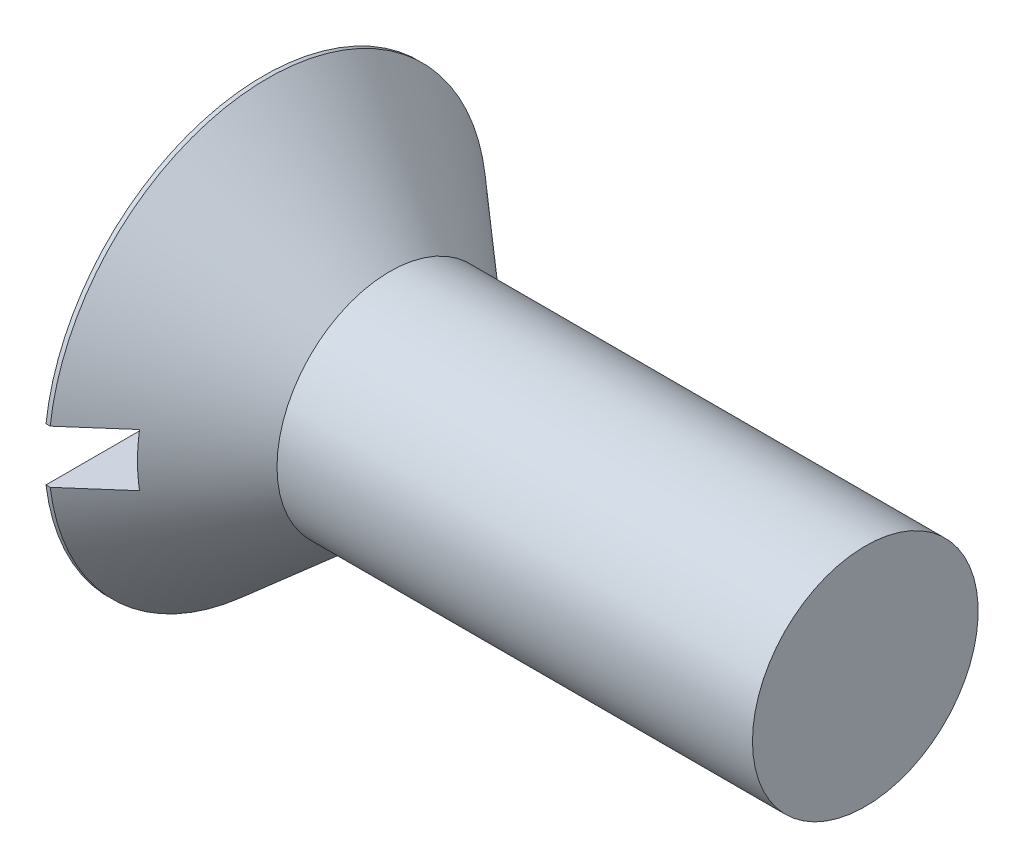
SolidWorks part; units mm, degrees
ref_plane "Plane1" through (0, 0, 0) normal (0, 0, 1) x (1, 0, 0)
ref_plane "Plane2" through (0, 0, 0) normal (0, 1, 0) x (1, 0, 0)
ref_plane "Plane3" through (0, 0, 0) normal (1, 0, 0) x (0, 0, -1)
revolve "Base-Revolve" add sketch "BodySke" angle 360 about L5
sketch "BodySke" plane through (0, 0, 0) normal (0, 0, 1) x (1, 0, 0)
  line L0 (0, 0) -> (0, 9.2456)
  line L1 (0, 9.2456) -> (0.1768, 9.2456)
  line L2 (5.334, 4.7625) -> (25.4, 4.7625)
  line L3 (25.4, 4.7625) -> (25.4, 0)
  line L4 (25.4, 0) -> (0, 0)
  line L5 (-6.35, 0) -> (82.55, 0) construction
  line L6 (5.334, -4.7625) -> (25.4, -4.7625) construction
  line L7 (0.1768, -9.2456) -> (5.334, -4.7625) construction
  line L8 (0.1768, 9.2456) -> (5.334, 4.7625)
  line L9 (0, -9.2456) -> (0.1768, -9.2456) construction
  line L10 (6.9215, 6.35) -> (6.9215, -3.175) construction
  line L11 (0, 6.35) -> (0, -3.175) construction
  dimension "Diameter" = 9.525
  dimension "Length" = 25.4
  dimension "Head_ht" = 5.334
  dimension "Head_dia" = 18.4912
  dimension "Head_ang" = 82
  dimension "D6" = 0.1768
  dimension "Advance" = 1.5875
  dimension "Thread_nom" = 25.4
extrude "Slot" cut sketch "Sketch6" against normal blind 2.1844
sketch "Sketch6" plane through (0, 0, 0) normal (-1, 0, 0) x (0, 0, 1)
  line L0 (-9.2456, -1.1176) -> (9.2456, -1.1176)
  line L1 (-9.2456, -1.1176) -> (-9.2456, 1.1176)
  line L2 (9.2456, 1.1176) -> (-9.2456, 1.1176)
  line L3 (9.2456, 1.1176) -> (9.2456, -1.1176)
  dimension "D1" = 1.1176
  dimension "Slot_width" = 2.2352
  dimension "D2" = 18.4912
  dimension "D3" = 9.2456
sketch "ThdSchSke" plane through (0, 0, 0) normal (0, 0, 1) x (1, 0, 0)
  line L0 (6.9215, -3.8163) -> (6.259, -4.7625)
  line L1 (6.9215, -3.8163) -> (7.584, -4.7625)
  line L2 (7.584, -4.7625) -> (7.584, -5.9531)
  line L3 (-3.175, 0) -> (5.1513, 0) construction
  line L5 (7.584, -5.9531) -> (6.259, -5.9531)
  line L6 (6.259, -5.9531) -> (6.259, -4.7625)
  line L7 (0, 9.2456) -> (0, 1.1176) construction
  dimension "Thread_minor" = 7.6327
  dimension "Diameter" = 9.525
  dimension "Start" = 6.9215
  dimension "SideAngle" = 55
  dimension "VeeAngle" = 70
  dimension "Overcut" = 11.9063
revolve "ThreadSchematic" [suppressed] cut sketch "ThdSchSke" angle 360 about L3
pattern_linear "ThdSchPat" [suppressed]
equation "\"D1@Sketch6\" = \"Slot_width@Sketch6\" / 2"
equation "\"D2@Sketch6\" = \"Head_dia@BodySke\""
equation "\"D3@Sketch6\" = \"D2@Sketch6\" / 2"
equation "\"Thread_length@ThreadCosmetic\" = ((sgn( (\"Length@BodySke\" - \"Advance@BodySke\" - \"Head_ht@BodySke\" ) - \"Thread_nom@BodySke\" )-1)*( (\"Length@BodySke\" - \"Advance@BodySke\" - \"Head_ht@BodySke\" ) - \"Thread_"
equation "\"Thread_minor@ThdSchSke\" = \"Thread_minor@ThreadCosmetic\""
equation "\"Diameter@ThdSchSke\" = \"Diameter@BodySke\""
equation "\"Overcut@ThdSchSke\" = \"Diameter@BodySke\" * 1.25"
equation "\"Start@ThdSchSke\" = 0.000001 + \"Length@BodySke\" - \"Thread_length@ThreadCosmetic\"  '---Countersunk---"
equation "\"Num_threads@ThdSchPat\" = int( \"Thread_length@ThreadCosmetic\" / \"Advance@BodySke\" + 0.999 )  + 1"
equation "\"Advance@ThdSchPat\" = \"Thread_length@ThreadCosmetic\" /  (\"Num_threads@ThdSchPat\" - 1) 'relax it"
